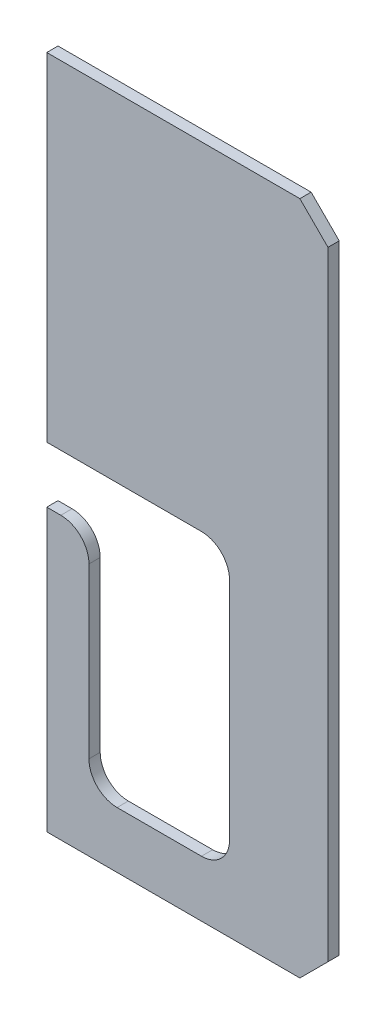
SolidWorks part; units mm, degrees
ref_plane "Plan de face" through (0, 0, 0) normal (0, 0, 1) x (1, 0, 0)
ref_plane "Plan de dessus" through (0, 0, 0) normal (0, 1, 0) x (1, 0, 0)
ref_plane "Plan de droite" through (0, 0, 0) normal (1, 0, 0) x (0, 0, -1)
sketch "Esquisse1" plane through (0, 0, 0) normal (0, 0, 1) x (1, 0, 0)
  line L0 (55, 120) -> (0, 120)
  line L1 (0, 0) -> (90, 0)
  line L2 (0, 0) -> (0, 100)
  line L3 (0, 240) -> (90, 240)
  line L4 (0, 120) -> (0, 240)
  line L5 (65, 110) -> (65, 30)
  line L6 (0, 100) -> (5, 100)
  line L7 (100, 10) -> (100, 230)
  line L8 (90, 240) -> (100, 230)
  line L9 (90, 0) -> (100, 10)
  line L10 (15, 90) -> (15, 30)
  line L11 (25, 20) -> (55, 20)
  arc A0 (25, 20) -> (15, 30) centre (25, 30) cw
  arc A1 (55, 20) -> (65, 30) centre (55, 30) ccw
  arc A2 (65, 110) -> (55, 120) centre (55, 110) ccw
  arc A3 (15, 90) -> (5, 100) centre (5, 90) ccw
  point P10 (100, 240)
  point P15 (15, 20)
  point P18 (65, 20)
  point P21 (65, 120)
  point P24 (15, 100)
  dimension "D10" = 10
  dimension "D11" = 10
  dimension "D3" = 10
  dimension "D4" = 15
  dimension "D8" = 45
  dimension "D1" = 100
  dimension "D2" = 240
  dimension "D5" = 20
  dimension "D6" = 100
  dimension "D7" = 50
  dimension "D9" = 20
extrude "Extrusion1" add sketch "Esquisse1" along normal blind 4
